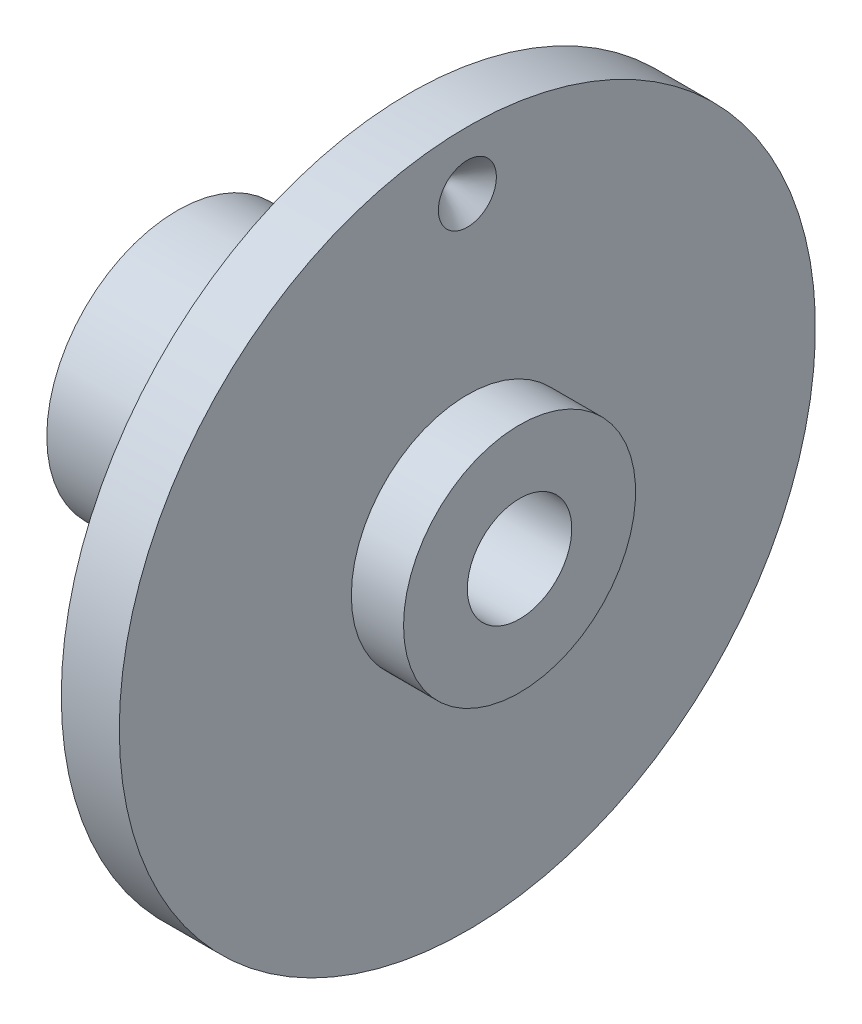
SolidWorks part; units mm, degrees
ref_plane "Plan1" through (0, 0, 0) normal (0, 0, 1) x (1, 0, 0)
ref_plane "Plan2" through (0, 0, 0) normal (0, 1, 0) x (1, 0, 0)
ref_plane "Plan3" through (0, 0, 0) normal (1, 0, 0) x (0, 0, -1)
sketch "Esquisse1" plane through (0, 0, 0) normal (0, 0, 1) x (1, 0, 0)
  line L0 (-20, 0) -> (90, 0) construction
  line L1 (0, 9) -> (59, 9)
  line L2 (59, 9) -> (59, 20)
  line L3 (59, 20) -> (50, 20)
  line L4 (50, 20) -> (50, 60)
  line L5 (50, 60) -> (40, 60)
  line L6 (40, 60) -> (40, 22.5)
  line L7 (40, 22.5) -> (0, 22.5)
  line L8 (0, 22.5) -> (0, 9)
  dimension "D1" = 9
  dimension "D2" = 20
  dimension "D3" = 60
  dimension "D4" = 22.5
  dimension "D5" = 40
  dimension "D6" = 10
  dimension "D7" = 9
revolve "Base-Révolution" add sketch "Esquisse1" angle 360 about L0
sketch "Esquisse2" plane through (0, 0, 0) normal (0, 0, 1) x (1, 0, 0)
  line L0 (21.3087, 50) -> (85.137, 50) construction
  line L1 (59, 20) -> (50, 20) construction
  line L2 (45, 50) -> (50, 55)
  line L3 (50, -60) -> (50, 60) construction
  line L4 (45, 50) -> (50, 50)
  line L5 (50, 55) -> (50, 50)
  dimension "D1" = 30
  dimension "D2" = 45
  dimension "D3" = 5
revolve "Enlèvement de matière-Révolution1" cut sketch "Esquisse2" angle 360 about L0
ref_plane "Plan4" through (0, 0, 0) normal (0, -0.7071, 0.7071) x (1, 0, 0)
sketch "Esquisse4" plane through (0, 0, 0) normal (0, -0.7071, 0.7071) x (1, 0, 0)
  line L0 (0, 22.5) -> (0, -22.5) construction
  circle A0 centre (15, 0) radius 3.7
  dimension "D1" = 15
  dimension "D2" = 7.4
extrude "Enlèv. mat.-Extru.2" cut sketch "Esquisse4" against normal mid plane 50
